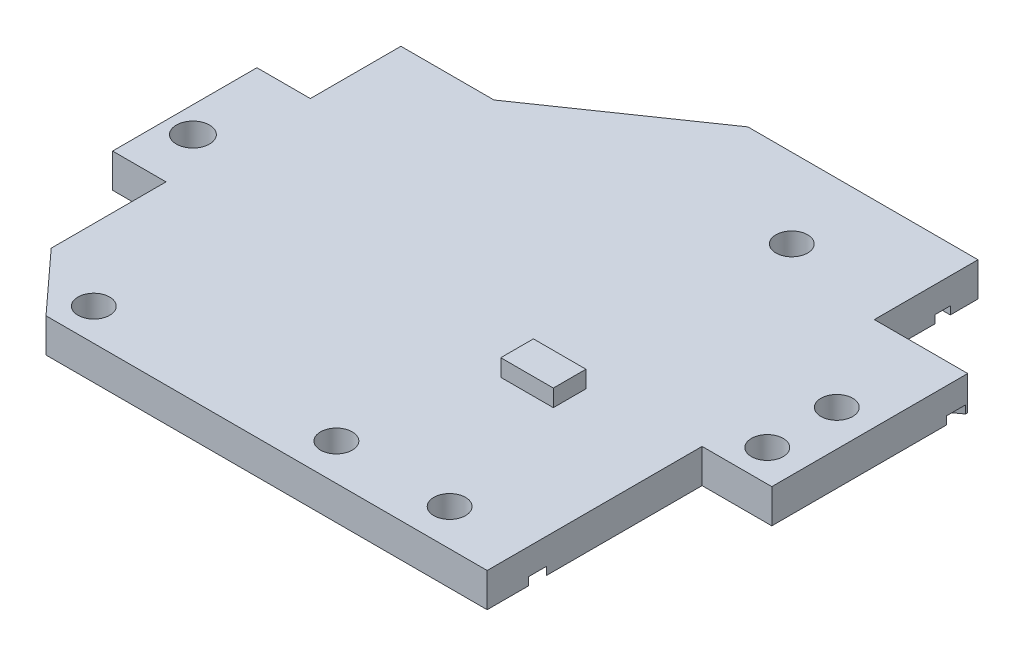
SolidWorks part; units mm, degrees
ref_plane "Front Plane" through (0, 0, 0) normal (0, 0, 1) x (1, 0, 0)
ref_plane "Top Plane" through (0, 0, 0) normal (0, 1, 0) x (1, 0, 0)
ref_plane "Right Plane" through (0, 0, 0) normal (1, 0, 0) x (0, 0, -1)
sketch "Sketch1" plane through (0, 0, 0) normal (0, 1, 0) x (1, 0, 0)
  line L2 (19.0774, 15.8793) -> (19.0774, -31.9708)
  line L3 (19.0774, -31.9708) -> (66.2294, -31.9708)
  line L4 (66.2294, 15.8765) -> (66.2294, 6.62)
  line L6 (42.7361, 15.8751) -> (42.7361, -24.2771)
  line L7 (42.7361, -24.2771) -> (62.7993, -24.2771)
  line L8 (62.7993, 15.8751) -> (62.7993, -24.2771)
  line L9 (40.4663, 15.8751) -> (19.0774, 15.8793)
  line L15 (40.4663, 15.8751) -> (42.7361, 15.8751)
  line L16 (66.2294, -5.5269) -> (66.2294, -31.9708)
  line L17 (62.7993, 15.8751) -> (66.2294, 15.8765)
  line L18 (66.2294, 6.62) -> (70.4764, 6.62)
  line L20 (66.2294, -5.5269) -> (70.4764, -5.5269)
  line L21 (70.4764, 6.62) -> (70.4764, -5.5269)
  circle A0 centre (47.7283, -27.6742) radius 1.4
  circle A1 centre (57.7282, -27.6824) radius 1.4
  dimension "D1" = 2.8
  dimension "D3" = 2.8
  dimension "D2" = 47.8501
extrude "Boss-Extrude1" add sketch "Sketch1" along normal blind 2
sketch "Sketch2" plane through (0, 0, 0) normal (0, -1, 0) x (1, 0, 0)
  line L0 (70.4764, -6.62) -> (66.2294, -6.62) construction
  line L1 (64.282, -6.1352) -> (62.9814, -6.1352)
  line L2 (64.282, 0.0403) -> (64.282, 29.7399)
  line L3 (64.282, 29.7399) -> (62.9814, 29.7399)
  line L4 (62.9814, -6.1352) -> (62.9814, 29.7399)
  line L5 (64.3452, -8.9554) -> (63.2023, -8.9554)
  line L6 (64.3452, -8.9554) -> (64.3452, -15.2001)
  line L7 (64.3452, -15.2001) -> (63.2023, -15.2001)
  line L8 (63.2023, -8.9554) -> (63.2023, -15.2001)
  line L9 (64.282, 0.0403) -> (70.4764, 0.0403)
  line L10 (64.282, -6.1352) -> (64.282, -6.62)
  line L11 (64.282, -6.62) -> (70.4764, -6.62)
  line L12 (70.4764, 0.0403) -> (70.4764, -6.62)
extrude "Boss-Extrude2" add sketch "Sketch2" along normal blind 27
sketch "Sketch3" plane through (0.0031, 0, -15.883) normal (0.0002, 0, -1) x (-1, 0, -0.0002)
  line L0 (-42.3383, 0) -> (-42.3383, -5.689)
  line L1 (-40.4632, 0) -> (-19.0743, 0) construction
  line L2 (-42.3383, -5.689) -> (-20.4163, -5.689)
  line L3 (-20.4163, -5.689) -> (-20.4163, -3.7381)
  line L4 (-20.4163, -3.7381) -> (-40.3383, -3.7381)
  line L5 (-40.3383, -3.7381) -> (-40.3383, 2)
  line L6 (-40.4632, 2) -> (-19.0743, 2) construction
  line L7 (-40.3383, 2) -> (-42.3383, 2)
  line L8 (-42.3383, 2) -> (-42.3383, 0)
  dimension "D1" = 2
extrude "Boss-Extrude3" add sketch "Sketch3" against normal blind 48
sketch "Sketch4" plane through (0.0031, 0, -15.883) normal (0.0002, 0, -1) x (-1, 0, -0.0002)
  line L0 (-40.3383, -3.7381) -> (-40.3383, 0) construction
  line L1 (-11.3675, 5.2741) -> (-40.3383, 5.2741)
  line L2 (-11.3675, 5.2741) -> (-11.3675, -1.8691)
  line L3 (-11.3675, -1.8691) -> (-40.3383, -1.8691)
  line L4 (-40.3383, 5.2741) -> (-40.3383, -1.8691)
extrude "Cut-Extrude1" cut sketch "Sketch4" against normal blind 48
sketch "Sketch5" plane through (0, 0, -15.2001) normal (0, 0, -1) x (-1, 0, 0)
  line L0 (-66.2294, 0) -> (-64.3452, -6.5603)
  line L1 (-64.3452, -27) -> (-64.3452, 0) construction
  line L2 (-64.3452, -6.5603) -> (-63.771, 0.4924)
  line L3 (-63.771, 0.4924) -> (-66.2294, 0.4924)
  line L5 (-66.2294, 0.4924) -> (-66.2294, 0)
extrude "Boss-Extrude4" add sketch "Sketch5" against normal blind 45
sketch "Sketch6" plane through (0, -5.689, 0) normal (0, -1, 0) x (-1, 0, 0)
  line L1 (-22.2016, -4.4168) -> (-20.5254, -4.4168)
  line L2 (-22.2016, -4.4168) -> (-22.2016, -17.937)
  line L3 (-22.5254, -23.3249) -> (-20.5254, -23.3249)
  line L4 (-20.5254, -4.4168) -> (-20.5254, -23.3249)
  line L5 (-24.8254, -24.9408) -> (-22.5254, -24.9408)
  line L6 (-24.8254, -24.9408) -> (-24.8254, -17.937)
  line L7 (-24.8254, -17.937) -> (-22.2016, -17.937)
  line L8 (-22.5254, -24.9408) -> (-22.5254, -23.3249)
  dimension "D1" = 2
  dimension "D2" = 2.3
extrude "Boss-Extrude5" add sketch "Sketch6" along normal blind 21
sketch "Sketch7" plane through (0, -5.689, 0) normal (0, -1, 0) x (-1, 0, 0)
  line L1 (-18.6663, 5.3309) -> (-26.2754, 5.3309)
  line L2 (-18.6663, 5.3309) -> (-18.6663, 16.9949)
  line L3 (-18.6663, 16.9949) -> (-26.2754, 16.9949)
  line L4 (-26.2754, 5.3309) -> (-26.2754, 11.3641)
  line L5 (-26.2754, 11.3641) -> (-39.5152, 11.3641)
  line L7 (-26.2754, 16.9949) -> (-39.5152, 16.9949)
  line L8 (-39.5152, 11.3641) -> (-39.5152, 16.9949)
extrude "Cut-Extrude2" cut sketch "Sketch7" against normal blind 21
sketch "Sketch8" plane through (0, -5.689, 0) normal (0, -1, 0) x (-1, 0, 0)
  line L0 (-26.7273, -24.9569) -> (-24.5148, -23.8193)
  line L1 (-26.6784, -29.6612) -> (-36.6425, -29.6612)
  line L3 (-26.7273, -24.9569) -> (-36.6425, -24.9569)
  line L4 (-36.6425, -29.6612) -> (-36.6425, -24.9569)
  line L11 (-24.4092, -29.6612) -> (-26.6784, -29.6612)
  line L12 (-24.4092, -29.6612) -> (-20.6482, -25.2077)
  line L13 (-20.6482, -25.2077) -> (-20.5254, -23.3249)
  line L14 (-20.5254, -23.3249) -> (-24.5148, -23.0648)
  line L15 (-24.5148, -23.0648) -> (-24.5148, -23.8193)
  circle A0 centre (-24.8134, -26.6998) radius 1.4
  circle A1 centre (-33.5343, -27.2149) radius 1.4
  dimension "D1" = 2.8
  dimension "D2" = 2.8
extrude "Boss-Extrude6" add sketch "Sketch8" along normal blind 21
sketch "Sketch9" plane through (0, -5.689, 0) normal (0, -1, 0) x (-1, 0, 0)
  line L0 (-26.327, -31.9803) -> (-18.9619, -23.9294)
  line L1 (-17.9756, -34.5015) -> (-40.5376, -34.5015)
  line L2 (-17.9756, -34.5015) -> (-17.9756, -29.6008)
  line L3 (-26.327, -31.9803) -> (-40.5376, -31.9803)
  line L4 (-40.5376, -34.5015) -> (-40.5376, -31.9803)
  line L5 (-18.9619, -23.9294) -> (-17.9756, -29.6008)
extrude "Cut-Extrude3" cut sketch "Sketch9" against normal blind 21
sketch "Sketch10" plane through (64.3452, 0, 0) normal (1, 0, 0) x (0, 0, -1)
  line L0 (8.9554, -27) -> (8.9554, -6.5603) construction
  line L1 (8.9554, -15.4646) -> (10.7944, -15.4646)
  line L2 (8.9554, -15.4646) -> (8.9554, -21.8199)
  line L3 (8.9554, -21.8199) -> (10.7944, -21.8199)
  line L4 (10.7944, -15.4646) -> (10.7944, -21.8199)
extrude "Cut-Extrude4" cut sketch "Sketch10" against normal blind 21
sketch "Sketch11" plane through (0, 0, -6.62) normal (0, 0, -1) x (-1, 0, 0)
  circle A0 centre (-65.4183, -14.794) radius 1.4
  circle A1 centre (-65.4183, -24.794) radius 1.4
  dimension "D1" = 2.8
  dimension "D2" = 2.8
extrude "Cut-Extrude5" cut sketch "Sketch11" against normal blind 21
sketch "Sketch12" plane through (0, -3.7381, 0) normal (0, 1, 0) x (1, 0, 0)
  line L0 (37.8976, -29.1112) -> (37.8976, -27.1371) construction
  line L1 (36.4013, -29.1112) -> (36.4013, -27.1371)
  line L2 (39.3939, -29.1112) -> (39.3939, -27.1371)
  arc A2 (36.4013, -29.1112) -> (39.3939, -29.1112) centre (37.8976, -29.1112) ccw
  arc A3 (39.3939, -27.1371) -> (36.4013, -27.1371) centre (37.8976, -27.1371) ccw
  point P2 (37.8976, -28.1241)
extrude "Cut-Extrude6" cut sketch "Sketch12" against normal blind 21
sketch "Sketch13" plane through (40.3383, 0, 0.0079) normal (-1, 0, -0.0002) x (-0.0002, 0, 1)
  line L0 (31.9724, 2) -> (-15.883, 2) construction
  line L1 (19.6427, 2) -> (12.6082, 2)
  line L2 (19.6427, 2) -> (19.6427, 0.162)
  line L3 (19.6427, 0.162) -> (12.6082, 0.162)
  line L4 (12.6082, 2) -> (12.6082, 0.162)
  line L6 (-4.5374, 2) -> (4.8702, 2)
  line L7 (-4.5374, 2) -> (-4.5374, 0.162)
  line L8 (-4.5374, 0.162) -> (4.8702, 0.162)
  line L9 (4.8702, 2) -> (4.8702, 0.162)
extrude "Boss-Extrude7" add sketch "Sketch13" along normal blind 20
sketch "Sketch15" plane through (0, -3.7381, 0) normal (0, 1, 0) x (1, 0, 0)
  circle A0 centre (31.5636, 7.1386) radius 1.4
  dimension "D1" = 2.8
sketch "Sketch17" plane through (0, -3.7381, 0) normal (0, 1, 0) x (1, 0, 0)
  line L0 (20.4174, 5.3309) -> (26.2754, 5.3309) construction
  line L1 (20.7411, 5.3309) -> (22.9693, 5.3309)
  line L2 (20.7411, 5.3309) -> (20.7411, -23.1903)
  line L3 (20.7411, -23.1903) -> (22.9693, -23.1903)
  line L4 (22.9693, 5.3309) -> (22.9693, -23.1903)
extrude "Boss-Extrude9" add sketch "Sketch17" along normal blind 2
sketch "Sketch18" plane through (0, 2, 0) normal (0, 1, 0) x (1, 0, 0)
  line L0 (20.3344, -19.6467) -> (40.3344, -19.6506) construction
  line L1 (20.3392, 4.5335) -> (23.0258, 4.5335)
  line L2 (20.3392, 4.5335) -> (20.3392, -19.6472)
  line L3 (20.3392, -19.6472) -> (23.0258, -19.6472)
  line L4 (23.0258, 4.5335) -> (23.0258, -3.2457)
  line L5 (23.0258, -12.6127) -> (22.1239, -3.2457)
  line L6 (20.3358, -12.6122) -> (40.3358, -12.6161) construction
  line L7 (21.9141, 11.2525) -> (22.3337, -17.744) construction
  line L8 (22.1239, -3.2457) -> (23.0258, -3.2457)
  line L9 (23.0258, -12.6127) -> (23.0258, -19.6472)
extrude "Boss-Extrude10" add sketch "Sketch18" against normal blind 5
extrude "Cut-Extrude7" cut sketch "Sketch15" against normal blind 5
sketch "Sketch19" plane through (0, 2, 0) normal (0, 1, 0) x (1, 0, 0)
  circle A0 centre (31.8816, 0) radius 1.4
  dimension "D1" = 2.8
extrude "Cut-Extrude8" cut sketch "Sketch19" against normal blind 5
sketch "Sketch20" plane through (0, -27, 0) normal (0, -1, 0) x (-1, 0, 0)
  line L0 (-42.332, -31.9708) -> (-66.2294, -31.9708) construction
  line L1 (-64.2721, -31.9708) -> (-26.3184, -31.9708)
  line L2 (-64.2721, -31.9708) -> (-64.2721, -11.9546)
  line L3 (-64.2721, 5.3309) -> (-62.1813, 5.3309)
  line L4 (-20.4174, -25.5204) -> (-20.4174, -15.3918)
  line L5 (-20.4113, -25.5138) -> (-26.327, -31.9803)
  line L6 (-20.4174, -2.6591) -> (-20.4174, 5.3309)
  line L7 (-64.2721, 5.3309) -> (-70.4207, 5.3309)
  line L9 (-64.2721, -11.9546) -> (-70.4207, -11.9546)
  line L10 (-70.4207, 5.3309) -> (-70.4207, -11.9546)
  line L11 (-20.4174, -2.6591) -> (-15.704, -2.6591)
  line L13 (-20.4174, -15.3918) -> (-15.704, -15.3918)
  line L14 (-15.704, -2.6591) -> (-15.704, -15.3918)
  line L15 (-41.8835, 14.4762) -> (-28.6254, 5.3309)
  line L17 (-62.1813, 5.3309) -> (-62.1813, 14.4762)
  line L18 (-62.1813, 14.4762) -> (-41.8835, 14.4762)
  line L20 (-28.6254, 5.3309) -> (-20.4174, 5.3309)
  circle A0 centre (-57.7282, -27.6824) radius 1.4
  circle A1 centre (-47.7283, -27.6742) radius 1.4
  circle A2 centre (-26.7273, -28.0719) radius 1.4
  circle A5 centre (-67.2342, -3.0317) radius 1.4
  circle A6 centre (-67.2342, -9.1644) radius 1.4
  circle A8 centre (-17.9896, -10.5897) radius 1.4614
  circle A9 centre (-52.7569, 7.4724) radius 1.4
  dimension "D1" = 2.8
  dimension "D2" = 2.8
  dimension "D3" = 2.8
sketch "Sketch21" plane through (0, 0, 0) normal (0, -1, 0) x (1, 0, 0)
  line L1 (64.1395, 31.9708) -> (42.3335, 31.9708)
  line L2 (64.1395, 31.9708) -> (64.1395, 24.6919)
  line L3 (64.1395, 24.6919) -> (42.3335, 24.6919)
  line L4 (42.3335, 31.9708) -> (42.3335, 24.6919)
  circle A0 centre (47.7283, 27.6742) radius 1.4
  circle A1 centre (57.7282, 27.6824) radius 1.4
extrude "Boss-Extrude15" add sketch "Sketch21" along normal blind 25
sketch "Sketch23" plane through (70.4764, 0, 0) normal (1, 0, 0) x (0, 0, -1)
  line L0 (-11.707, -21.3347) -> (0.7084, -8.9193)
  line L1 (-0.0403, -27) -> (-11.707, -27)
  line L2 (-0.0403, -27) -> (-0.0403, -21.3347)
  line L4 (-11.707, -27) -> (-11.707, -21.3347)
  line L5 (0.7084, -8.9193) -> (1.1682, -20.8478)
  line L6 (1.1682, -20.8478) -> (-0.0403, -21.3347)
extrude "Boss-Extrude16" add sketch "Sketch23" against normal blind 7
sketch "Sketch24" plane through (0, -27, 0) normal (0, -1, 0) x (1, 0, 0)
  circle A0 centre (67.2342, 3.0317) radius 1.4
  circle A1 centre (67.2342, 9.1644) radius 1.4
extrude "Cut-Extrude9" cut sketch "Sketch24" against normal blind 13
sketch "Sketch25" plane through (0, -26.689, 0) normal (0, -1, 0) x (1, 0, 0)
  line L0 (15.704, 15.3918) -> (20.8933, 19.7353)
  line L1 (20.5254, 4.4168) -> (15.704, 4.4168)
  line L2 (20.5254, 4.4168) -> (20.5254, 15.3918)
  line L4 (15.704, 4.4168) -> (15.704, 15.3918)
  line L5 (20.8933, 19.7353) -> (20.5254, 15.3918)
  circle A0 centre (18.0074, 12.3215) radius 1.4
  circle A1 centre (18.0074, 7.331) radius 1.4
  dimension "D1" = 2.8
  dimension "D2" = 2.8
extrude "Boss-Extrude17" add sketch "Sketch25" against normal blind 28
extrude "Boss-Extrude18" add sketch "Sketch20" along normal blind 3
sketch "Sketch26" plane through (0, 0, -6.62) normal (0, 0, -1) x (-1, 0, 0)
  line L1 (-15.704, -27) -> (-71.5826, -27)
  line L2 (-15.704, -27) -> (-15.704, -26.7152)
  line L3 (-15.704, -26.7152) -> (-71.5826, -26.7152)
  line L4 (-71.5826, -27) -> (-71.5826, -26.7152)
extrude "Cut-Extrude10" cut sketch "Sketch26" against normal blind 70
delete or keep bodies "Body-Delete/Keep 1" type keep bodies bodies 125
sketch "Sketch27" plane through (0, -27, 0) normal (0, 1, 0) x (1, 0, 0)
  line L1 (54.7522, -12.6811) -> (50.1157, -12.6811)
  line L2 (54.7522, -12.6811) -> (54.7522, -15.5592)
  line L3 (54.7522, -15.5592) -> (50.1157, -15.5592)
  line L4 (50.1157, -12.6811) -> (50.1157, -15.5592)
extrude "Boss-Extrude19" add sketch "Sketch27" along normal blind 1.5
sketch "Sketch28" plane through (0, -30, 0) normal (0, -1, 0) x (-1, 0, 0)
  line L0 (-25.3418, -21.1532) -> (-31.943, -27.7543)
  line L1 (-31.943, -27.7543) -> (-31.943, -30.1582)
  line L2 (-31.943, -30.1582) -> (-44.1914, -30.1582)
  line L3 (-44.1914, -30.1582) -> (-44.1914, -24.4537)
  line L4 (-44.1914, -24.4537) -> (-61.4383, -24.4537)
  line L5 (-61.4383, -24.4537) -> (-66.3129, -29.3283)
  line L6 (-66.3129, -29.3283) -> (-67.1237, -28.5175)
  line L7 (-67.1237, -28.5175) -> (-62.2492, -23.6429)
  line L8 (-62.2492, -23.6429) -> (-44.1914, -23.6429)
  line L9 (-44.1914, -23.6429) -> (-43.0467, -23.6429)
  line L10 (-43.0467, -23.6429) -> (-43.0467, -28.9563)
  line L11 (-43.0467, -28.9563) -> (-32.5916, -28.9563)
  line L12 (-32.5916, -28.9563) -> (-32.5916, -27.306)
  line L13 (-32.5916, -27.306) -> (-23.0667, -17.781)
  line L14 (-23.0667, -17.781) -> (-21.1108, -17.781)
  line L15 (-21.1108, -17.781) -> (-21.1108, -29.3283)
  line L16 (-21.1108, -29.3283) -> (-21.6867, -29.3283)
  line L17 (-21.6867, -29.3283) -> (-21.6867, -18.6169)
  line L18 (-21.6867, -18.6169) -> (-23.0667, -18.6169)
  line L19 (-23.0667, -18.6169) -> (-25.3418, -21.1532)
  line L20 (-28.1696, -11.8821) -> (-33.5855, -17.298)
  line L21 (-33.5855, -17.298) -> (-37.4191, -17.298)
  line L22 (-28.1696, -11.8821) -> (-28.1696, -3.1803)
  line L23 (-32.5916, 3.2092) -> (-55.6748, 3.2092)
  line L24 (-61.334, -12.4298) -> (-61.334, -3.0647)
  line L25 (-55.6748, -17.298) -> (-61.334, -12.4298)
  line L26 (-28.1696, -3.1803) -> (-32.5916, 3.2092)
  line L27 (-55.6748, 3.2092) -> (-60.5693, -2.0708)
  line L28 (-37.4191, -17.298) -> (-37.4191, -20.0247)
  line L29 (-37.4191, -20.0247) -> (-53.4232, -20.0247)
  line L30 (-53.4232, -20.0247) -> (-53.4232, -17.298)
  line L31 (-53.4232, -17.298) -> (-55.6748, -17.298)
  line L32 (-29.9061, -12.0774) -> (-34.3547, -16.526)
  line L33 (-34.3547, -16.526) -> (-38.0952, -16.526)
  line L34 (-29.9061, -12.0774) -> (-29.9061, -2.0708)
  line L35 (-33.262, 2.6072) -> (-55.2004, 2.6072)
  line L36 (-60.0153, -12.5268) -> (-60.0153, -2.5645)
  line L37 (-55.3949, -16.526) -> (-60.0153, -12.5268)
  line L38 (-29.9061, -2.0708) -> (-33.262, 2.6072)
  line L39 (-55.2004, 2.6072) -> (-60.0153, -2.5645)
  line L40 (-38.0952, -16.526) -> (-38.0952, -18.9721)
  line L41 (-38.0952, -18.9721) -> (-52.7587, -18.9721)
  line L42 (-52.7587, -18.9721) -> (-52.7587, -16.526)
  line L43 (-52.7587, -16.526) -> (-55.3949, -16.526)
  line L44 (-41.9465, 12.7545) -> (-30.226, 5.261)
  line L45 (-66.0973, 12.0311) -> (-42.8138, 12.0311)
  line L46 (-66.0973, 12.0311) -> (-66.0973, 15.7489)
  line L47 (-66.0973, 15.7489) -> (-42.8138, 15.7489)
  line L48 (-42.8138, 12.0311) -> (-42.8138, 15.7489)
  line L49 (-42.3985, 10.682) -> (-67.1237, 10.682)
  line L50 (-41.9465, 12.7545) -> (-41.9465, 16.4768)
  line L51 (-41.9465, 16.4768) -> (-67.1237, 16.4768)
  line L52 (-67.1237, 10.682) -> (-67.1237, 16.4768)
  line L53 (-30.226, 5.261) -> (-28.1696, 7.7935)
  line L54 (-28.1696, 7.7935) -> (-27.7306, 7.437)
  line L55 (-27.7306, 7.437) -> (-31.0089, 3.3999)
  line L56 (-31.0089, 3.3999) -> (-42.3985, 10.682)
  line L57 (-60.5693, -2.0708) -> (-71.1983, 5.7093)
  line L58 (-71.1983, 5.7093) -> (-72.0008, 4.6129)
  line L59 (-72.0008, 4.6129) -> (-61.334, -3.0647)
  circle A0 centre (-25.3418, -14.9697) radius 2.8278
  circle A1 centre (-25.3418, -14.9697) radius 2.3075
  circle A2 centre (-58.3853, -20.3018) radius 2.4141
  circle A3 centre (-58.3853, -20.3018) radius 1.7886
  circle A4 centre (-62.2492, 1.4317) radius 1.0822
  circle A5 centre (-62.2492, 1.4317) radius 0.7611
  circle A6 centre (-24.9913, 0.6707) radius 1.4966
  circle A7 centre (-24.9913, 0.6707) radius 0.7987
extrude "Cut-Extrude11" cut sketch "Sketch28" against normal blind 0.7
fillet "Fillet1" radius 1 21 edges at (61.334, -29.65, 3.0647) (61.334, -29.65, 12.4298) (55.6748, -29.65, 17.298) (53.4232, -29.65, 20.0247) (38.0952, -29.65, 16.526) (33.5855, -29.65, 17.298) (37.4191, -29.65, 17.298) (37.4191, -29.65, 20.0247) (31.943, -29.65, 27.7543) (32.5916, -29.65, 27.306) (32.5916, -29.65, 28.9563) (31.943, -29.65, 30.1582) (44.1914, -29.65, 30.1582) (43.0467, -29.65, 28.9563) (43.0467, -29.65, 23.6429) (44.1914, -29.65, 24.4537) (52.7587, -29.65, 18.9721) (60.0153, -29.65, 2.5645) (60.5693, -29.65, 2.0708) (60.0153, -29.65, 12.5268) (55.3949, -29.65, 16.526)
sketch "Sketch29" plane through (0, -27, 0) normal (0, 1, 0) x (1, 0, 0)
  line L1 (65.6794, -36.9538) -> (21.5391, -36.9538)
  line L2 (65.6794, -36.9538) -> (65.6794, -30.9161)
  line L3 (65.6794, -30.9161) -> (21.5391, -30.9161)
  line L4 (21.5391, -36.9538) -> (21.5391, -30.9161)
extrude "Cut-Extrude12" cut sketch "Sketch29" against normal blind 5
